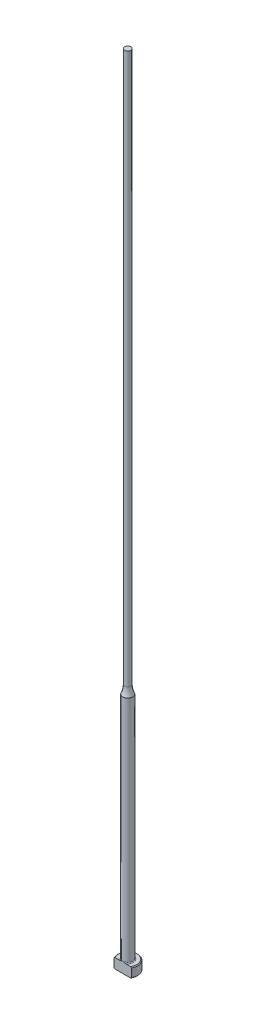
SolidWorks part; units mm, degrees
ref_plane "Front Plane" through (0, 0, 0) normal (0, 0, 1) x (1, 0, 0)
ref_plane "Top Plane" through (0, 0, 0) normal (0, 1, 0) x (1, 0, 0)
ref_plane "Right Plane" through (0, 0, 0) normal (1, 0, 0) x (0, 0, -1)
sketch "Sketch1" plane through (0, 0, 0) normal (0, 0, 1) x (1, 0, 0)
  line L0 (0, 259.9588) -> (0, -15.1925) construction
  line L1 (0, 0) -> (-3.175, 0)
  line L2 (-3.175, 0) -> (-3.175, 3.175)
  line L3 (-3.175, 3.175) -> (-1.5875, 3.175)
  line L4 (-0.9919, 78.8851) -> (-0.9919, 254)
  line L5 (-0.9919, 254) -> (0, 254)
  line L6 (0, 254) -> (0, 0)
  line L7 (-1.5875, 3.175) -> (-1.5875, 76.2)
  arc A0 (-1.5875, 76.2) -> (-0.9919, 78.8851) centre (-7.3419, 78.8851) ccw
  point P13 (-1.5875, 0)
  dimension "D1" = 6.35
  dimension "L" = 254
  dimension "D2" = 3.175
  dimension "H" = 6.35
  dimension "T" = 3.175
  dimension "D" = 1.9837
  dimension "S" = 76.2
revolve "Revolve1" add sketch "Sketch1" angle 360 about L0
chamfer "Chamfer1" distance 0.254 angle 45 2 edges at (0, 3.175, 3.175) (0, 0, 3.175)
fillet "Fillet1" radius 0.254 1 edges at (0, 3.175, 1.5875)
sketch "Sketch2" plane through (0, 0, 0) normal (0, -1, 0) x (1, 0, 0)
  line L0 (-2.7496, 1.5875) -> (2.7496, 1.5875)
  circle A0 centre (0, 0) radius 3.175 construction
  arc A1 (2.7496, 1.5875) -> (-2.7496, 1.5875) centre (0, 0) ccw
  circle A4 centre (0, 0) radius 1.5875 construction
  dimension "D1" = 0
extrude "KEY" cut sketch "Sketch2" against normal through all
